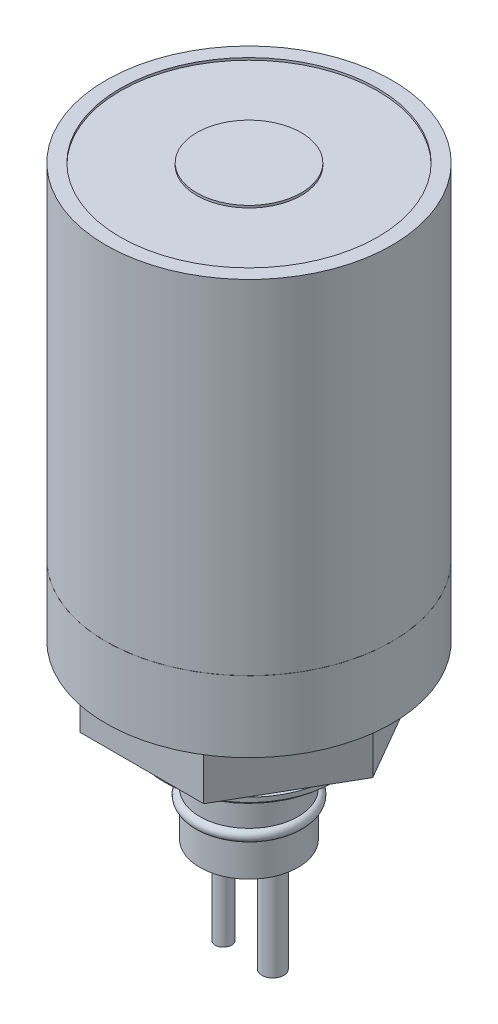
SolidWorks part; units mm, degrees
ref_plane "Front Plane" through (0, 0, 0) normal (0, 0, 1) x (1, 0, 0)
ref_plane "Top Plane" through (0, 0, 0) normal (0, 1, 0) x (1, 0, 0)
ref_plane "Right Plane" through (0, 0, 0) normal (1, 0, 0) x (0, 0, -1)
sketch "Sketch1" plane through (0, 0, 0) normal (0, 1, 0) x (1, 0, 0)
  circle A0 centre (0, 0) radius 15.875
  dimension "D1" = 31.75
extrude "Boss-Extrude1" add sketch "Sketch1" against normal blind 38.1
sketch "Sketch2" plane through (0, -38.1, 0) normal (0, -1, 0) x (1, 0, 0)
  circle A1 centre (0, 0) radius 15.875
  circle A2 centre (0, 0) radius 15.875
  dimension "D1" = 0
extrude "Boss-Extrude2" add sketch "Sketch2" along normal blind 7.874 from offset 0.0127 separate body
sketch "Sketch3" plane through (0, 0, 0) normal (0, 1, 0) x (1, 0, 0)
  circle A1 centre (0, 0) radius 5.8006
  circle A2 centre (0, 0) radius 14.3002
  circle A3 centre (0, 0) radius 14.3002
  dimension "D1" = 1.5748
extrude "Cut-Extrude1" cut sketch "Sketch3" against normal blind 0.254
hole_wizard "#6-32 Tapped Hole1" positions "Sketch10" profile "Sketch9" tap size "#6-32" standard "ANSI Inch"
sketch "Sketch10" plane through (0, -45.9867, 0) normal (0, -1, 0) x (-1, 0, 0)
  line L0 (0, 0) -> (0, -13.4937) construction
  line L3 (0, 0) -> (11.6859, 6.7469) construction
  line L4 (0, 0) -> (-11.6859, 6.7469) construction
  circle A0 centre (0, 0) radius 13.4938 construction
  point P0 (0, -13.4937)
  point P19 (11.6859, 6.7469)
  point P21 (-11.6859, 6.7469)
  dimension "D1" = 26.9875
  dimension "D2" = 120
  dimension "D3" = 120
sketch "Sketch9" plane through (0, -45.9867, 13.4937) normal (1, 0, 0) x (0, 0, -1)
  line L0 (0, 0) -> (0, 10.2107)
  line L1 (0, 10.2107) -> (1.3525, 9.398)
  line L2 (1.3525, 9.398) -> (1.3525, 0)
  line L5 (1.3525, 0) -> (0, 0)
  line L10 (0, 10.2107) -> (-1.3526, 9.398) construction
  line L11 (0, -6.35) -> (0, 107.95) construction
  dimension "Tap Drill Dia." = 2.7051
  dimension "Tap Drill Depth" = 9.398
  dimension "Drill Angle" = 118
hole_wizard "7/16-20 Tapped Hole1" positions "Sketch13" profile "Sketch12" tap size "7/16-20" standard "ANSI Inch"
sketch "Sketch13" plane through (0, -45.9867, 0) normal (0, -1, 0) x (-1, 0, 0)
  point P0 (0.1409, -0.0855)
sketch "Sketch12" plane through (-0.1409, -45.9867, 0.0855) normal (1, 0, 0) x (0, 0, -1)
  line L0 (0, 0) -> (0, 13.4454)
  line L1 (0, 13.4454) -> (4.9606, 10.4648)
  line L2 (4.9606, 10.4648) -> (4.9606, 0)
  line L5 (4.9606, 0) -> (0, 0)
  line L10 (0, 13.4454) -> (-4.9606, 10.4648) construction
  line L11 (0, -6.35) -> (0, 107.95) construction
  dimension "Tap Drill Dia." = 9.9212
  dimension "Tap Drill Depth" = 10.4648
  dimension "Drill Angle" = 118
sketch "Sketch6" plane through (0, -45.9867, 0) normal (0, -1, 0) x (1, 0, 0)
  line L1 (13.7408, 0) -> (6.8704, 11.8999)
  line L2 (6.8704, 11.8999) -> (-6.8704, 11.8999)
  line L3 (-6.8704, 11.8999) -> (-13.7408, 0)
  line L4 (-13.7408, 0) -> (-6.8704, -11.8999)
  line L5 (-6.8704, -11.8999) -> (6.8704, -11.8999)
  line L6 (6.8704, -11.8999) -> (13.7408, 0)
  circle A0 centre (0, 0) radius 11.8999 construction
  dimension "D1" = 23.7998
extrude "Impulse VSF-BCL" add sketch "Sketch6" along normal blind 6.2647
sketch "Sketch7" plane through (0, 0, 0) normal (0, 0, 1) x (1, 0, 0)
  line L0 (0, 0) -> (0, -103.7571) construction
  line L1 (0, -52.2514) -> (8.801, -52.2514)
  line L2 (6.8704, -52.2514) -> (-6.8704, -52.2514) construction
  line L3 (13.7408, -52.2514) -> (6.8704, -52.2514) construction
  line L4 (8.801, -52.2514) -> (8.801, -53.3489)
  line L5 (8.801, -53.3489) -> (9.398, -53.3489)
  line L6 (9.398, -53.3489) -> (9.398, -53.8569)
  line L7 (9.398, -53.8569) -> (8.801, -53.8569)
  line L8 (8.801, -53.8569) -> (8.801, -54.3649)
  line L9 (8.801, -54.3649) -> (9.398, -54.3649)
  line L10 (9.398, -54.3649) -> (9.398, -54.8729)
  line L11 (9.398, -54.8729) -> (8.801, -54.8729)
  line L12 (8.801, -54.8729) -> (8.801, -55.3809)
  line L13 (8.801, -55.3809) -> (5.4537, -55.3809)
  line L14 (0, -55.3809) -> (0, -52.2514)
  line L15 (5.4537, -55.3809) -> (5.4537, -60.1507)
  line L16 (5.4537, -65.0367) -> (0, -65.0367)
  line L17 (0, -65.0367) -> (0, -55.3809)
  line L18 (5.4537, -61.3286) -> (5.4537, -65.0367)
  line L19 (-15.875, -45.9867) -> (15.875, -45.9867) construction
  arc A0 (5.4537, -61.3286) -> (5.4537, -60.1507) centre (5.4537, -60.7396) ccw
  dimension "D7" = 19.05
  dimension "D1" = 17.602
  dimension "D2" = 18.796
  dimension "D3" = 0.508
  dimension "D4" = 0.508
  dimension "D5" = 0.508
  dimension "D6" = 3.1295
revolve "Revolve1" add sketch "Sketch7" angle 360 about L0
sketch "Sketch11" plane through (0, -65.0367, 0) normal (0, -1, 0) x (1, 0, 0)
  circle A0 centre (-2.8405, 0) radius 0.9054
  circle A1 centre (2.6478, 0) radius 1.2131
extrude "Boss-Extrude5" add sketch "Sketch11" along normal blind 11.176
equation "\"Buoyancy\"=\"SW-Volume\"*(\"SW-Density\"-.037062)"
